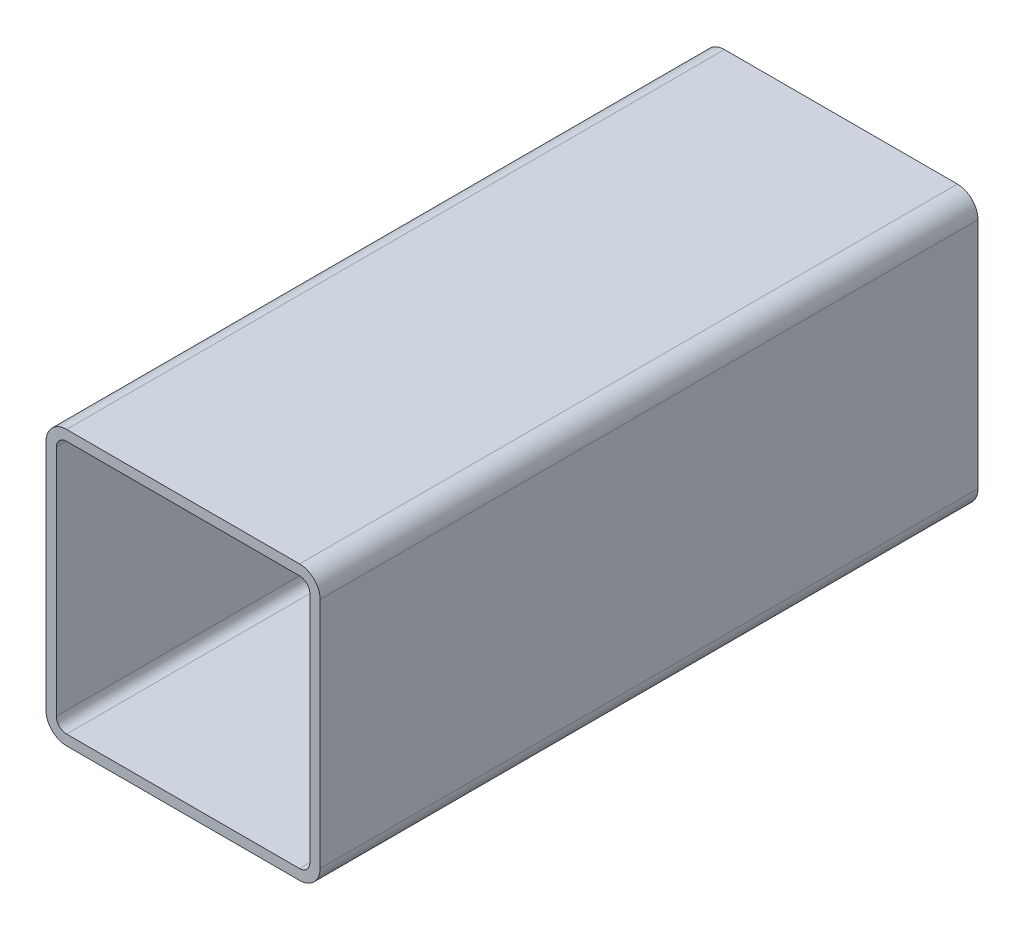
SolidWorks part; units mm, degrees
ref_plane "Front Plane" through (0, 0, 0) normal (0, 0, 1) x (1, 0, 0)
ref_plane "Top Plane" through (0, 0, 0) normal (0, 1, 0) x (1, 0, 0)
ref_plane "Right Plane" through (0, 0, 0) normal (1, 0, 0) x (0, 0, -1)
sketch "Sketch1" plane through (0, 0, 0) normal (0, 0, 1) x (1, 0, 0)
sketch_block_instance "HSS5x5x0.1875-1"
sketch_block "HSS5x5x0.1875"
extrude "Boss-Extrude1" add sketch "Sketch1" along normal blind 304.8
